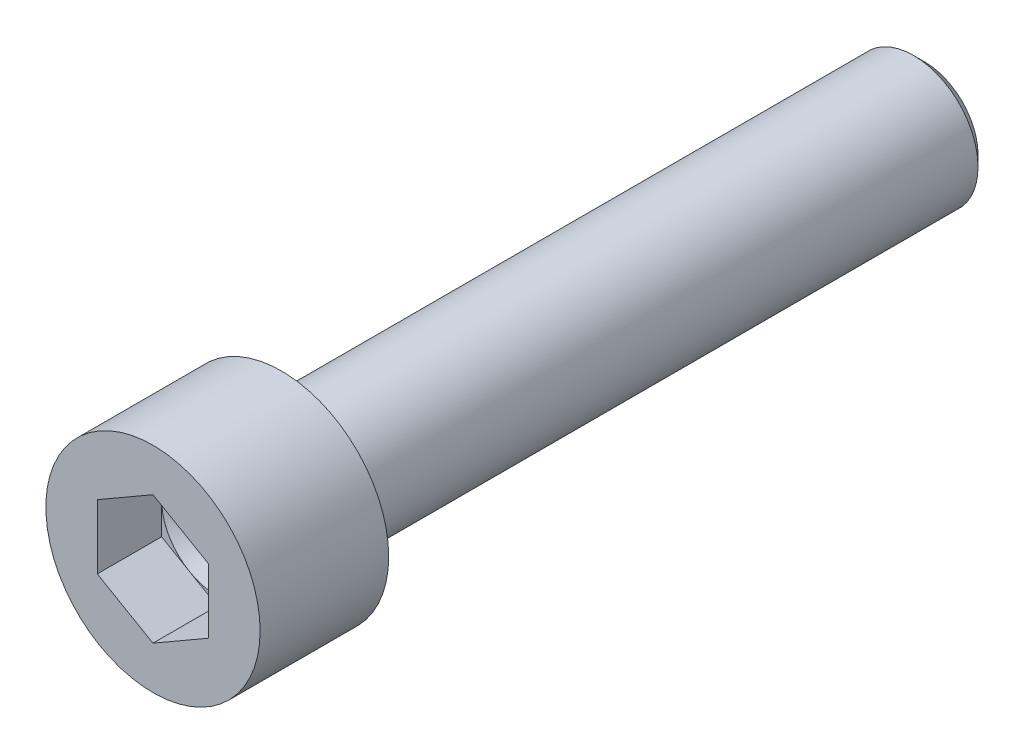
SolidWorks part; units mm, degrees
ref_plane "Face" through (0, 0, 0) normal (0, 0, 1) x (1, 0, 0)
ref_plane "Dessus" through (0, 0, 0) normal (0, 1, 0) x (1, 0, 0)
ref_plane "Droite" through (0, 0, 0) normal (1, 0, 0) x (0, 0, -1)
sketch "Esquisse1" plane through (0, 0, 0) normal (0, 0, 1) x (1, 0, 0)
  circle A0 centre (0, 0) radius 5
  dimension "D1" = 10
extrude "Extrusion2" add sketch "Esquisse1" against normal blind 6
sketch "Esquisse2" plane through (0, 0, -6) normal (0, 0, -1) x (-1, 0, 0)
  circle A0 centre (0, 0) radius 3
  dimension "D1" = 6
extrude "Extrusion3" add sketch "Esquisse2" along normal blind 30
sketch "Esquisse3" plane through (0, 0, 0) normal (0, 0, 1) x (1, 0, 0)
  line L1 (0, -3) -> (2.5981, -1.5)
  line L2 (2.5981, -1.5) -> (2.5981, 1.5)
  line L3 (2.5981, 1.5) -> (0, 3)
  line L4 (0, 3) -> (-2.5981, 1.5)
  line L5 (-2.5981, 1.5) -> (-2.5981, -1.5)
  line L6 (-2.5981, -1.5) -> (0, -3)
  circle A0 centre (0, 0) radius 2.5981 construction
  dimension "D1" = 3
extrude "Enlèv. mat.-Extru.1" cut sketch "Esquisse3" against normal blind 3
sketch "Esquisse4" plane through (0, 0, -3) normal (0, 0, 1) x (1, 0, 0)
  line L0 (2.5981, 1.5) -> (0, 3) construction
  circle A0 centre (0, 0) radius 2.5981
hole_wizard "Trou taraudé 1/16 NPT1" positions "Esquisse3D1" profile "Esquisse5" size "1/16" standard "Ansi Pouce"
sketch3d "Esquisse3D1"
  point P0 (0, 0, 0)
  point P2 (0, 0, -3)
sketch "Esquisse5" plane through (0, 0, -3) normal (1, 0, 0) x (0, -1, 0)
  line L0 (0, 0) -> (0, 1.5624)
  line L1 (2.6, 0.0002) -> (0, 1.5624)
  line L2 (-2.6, 0.0002) -> (0, 1.5624) construction
  line L3 (2.6, 0.0002) -> (2.6, 0.0001)
  line L4 (2.6, 0.0001) -> (3.7626, 0.0001)
  line L5 (3.7626, 0.0001) -> (3.7626, 0)
  line L6 (-3.7626, 0.0001) -> (-3.7626, 0) construction
  line L7 (3.7626, 0) -> (0, 0)
  line L8 (0, -6.35) -> (0, 107.95) construction
  line L11 (-2.6, 0.0001) -> (-3.7626, 0.0001) construction
  dimension "Diamètre du trou pour taraudage" = 5.2
  dimension "Profondeur du trou pour taraudage" = 0.0002
  dimension "Diamètre du filetage" = 7.5252
  dimension "Angle de filetage" = 3.43
  dimension "Profondeur du filetage" = 0.0001
  dimension "Angle de pointe" = 118
chamfer "Chanfrein1" distance 0.5 angle 45
